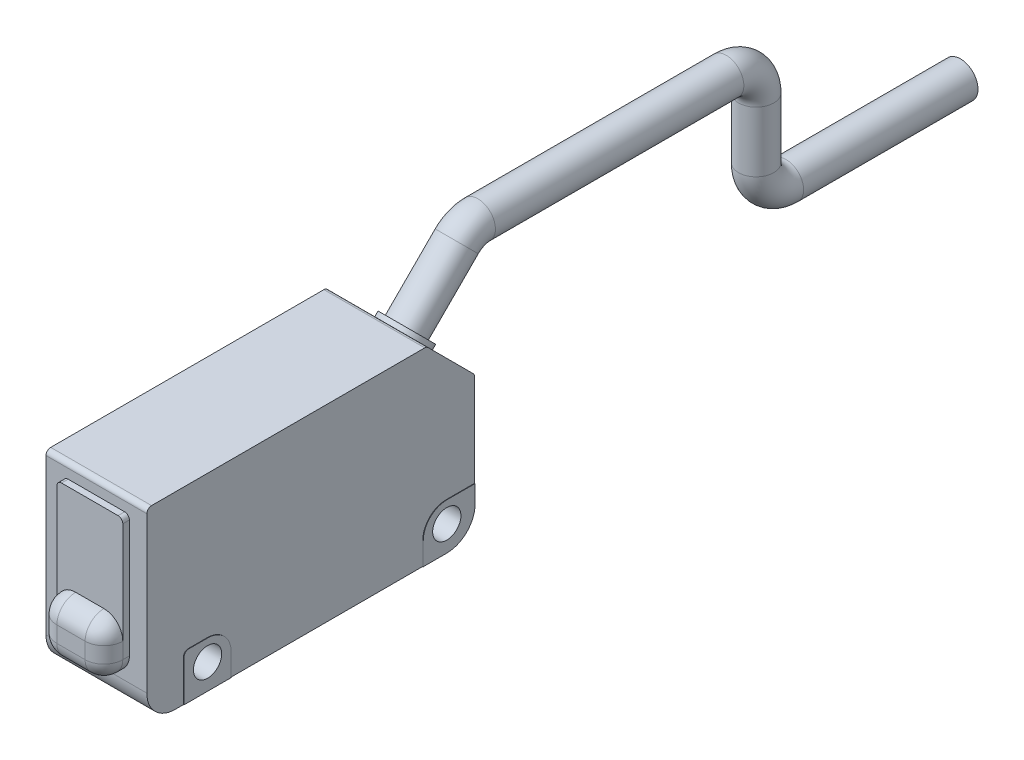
SolidWorks part; units mm, degrees
ref_plane "Front" through (0, 0, 0) normal (0, 0, 1) x (1, 0, 0)
ref_plane "Top" through (0, 0, 0) normal (0, 1, 0) x (1, 0, 0)
ref_plane "Right" through (0, 0, 0) normal (1, 0, 0) x (0, 0, -1)
imported_body "Imported1"
ref_plane "Plane1" through (0, 11.1988, -11.1988) normal (0, 0.7071, -0.7071) x (1, 0, 0)
other "SurfaceCut1"
sketch "Sketch1" plane through (0, 11.1988, -11.1988) normal (0, 0.7071, -0.7071) x (1, 0, 0)
  circle A0 centre (0, -9.6095) radius 1.8669 construction
  circle A1 centre (0, -9.6095) radius 1.8669
sketch "Sketch2" plane through (0, 0, 0) normal (1, 0, 0) x (0, 0, -1)
  line L0 (4.4039, 17.9938) -> (6.4567, 20.0466)
  line L1 (5.724, 16.6737) -> (3.0838, 19.3139) construction
  line L2 (8.7017, 20.9765) -> (35.0798, 20.9765)
  line L3 (38.2548, 17.8015) -> (38.2548, 11.3928)
  line L4 (41.4298, 8.2178) -> (59.9444, 8.2178)
  arc A0 (38.2548, 11.3928) -> (41.4298, 8.2178) centre (41.4298, 11.3928) ccw
  arc A1 (35.0798, 20.9765) -> (38.2548, 17.8015) centre (35.0798, 17.8015) cw
  arc A2 (6.4567, 20.0466) -> (8.7017, 20.9765) centre (8.7017, 17.8015) cw
  dimension "D1" = 3.175
sweep "Sweep1" add profiles "Sketch1" path "Sketch2"
